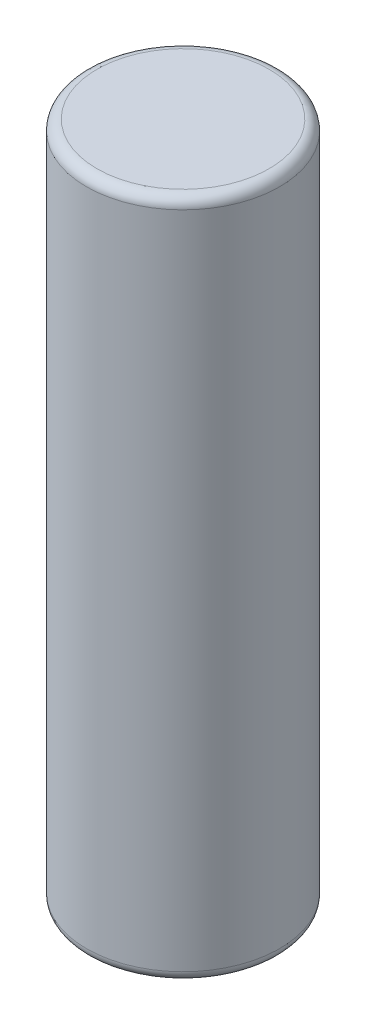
SolidWorks part; units mm, degrees
ref_plane "Front Plane" through (0, 0, 0) normal (0, 0, 1) x (1, 0, 0)
ref_plane "Top Plane" through (0, 0, 0) normal (0, 1, 0) x (1, 0, 0)
ref_plane "Right Plane" through (0, 0, 0) normal (1, 0, 0) x (0, 0, -1)
sketch "Sketch1" plane through (0, 0, 0) normal (0, 1, 0) x (1, 0, 0)
  circle A0 centre (0, 0) radius 9.25
  dimension "D1" = 18.5
extrude "Boss-Extrude1" add sketch "Sketch1" along normal blind 65.2
fillet "Fillet2" radius 1 2 edges at (0, 0, 9.25) (0, 65.2, 9.25)
